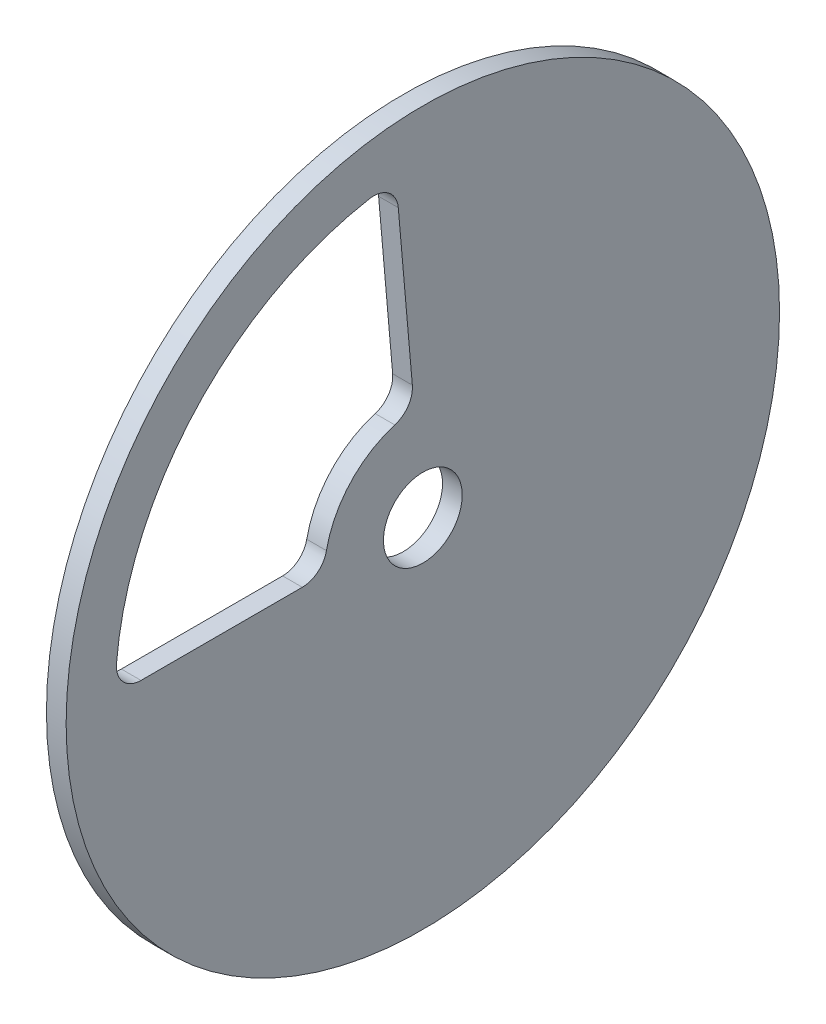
SolidWorks part; units mm, degrees
ref_plane "Front Plane" through (0, 0, 0) normal (0, 0, 1) x (1, 0, 0)
ref_plane "Top Plane" through (0, 0, 0) normal (0, 1, 0) x (1, 0, 0)
ref_plane "Right Plane" through (0, 0, 0) normal (1, 0, 0) x (0, 0, -1)
sketch "Sketch1" plane through (0, 0, 0) normal (1, 0, 0) x (0, 0, -1)
  line L0 (0, 0) -> (0, 13.3208) construction
  line L1 (-0.427, 4.8803) -> (-0.9985, 11.4128)
  line L2 (-4.899, 0) -> (-11.4564, 0)
  circle A0 centre (0, 0) radius 1.6
  circle A1 centre (0, 0) radius 14.5
  arc A2 (-2.1681, 12.3105) -> (-12.4527, 1.087) centre (0, 0) ccw
  arc A3 (-1.1385, 3.8345) -> (-3.9192, 0.8) centre (0, 0) ccw
  arc A4 (-4.899, 0) -> (-3.9192, 0.8) centre (-4.899, 1) ccw
  arc A5 (-0.427, 4.8803) -> (-1.1385, 3.8345) centre (-1.4232, 4.7932) cw
  arc A6 (-2.1681, 12.3105) -> (-0.9985, 11.4128) centre (-1.9947, 11.3257) cw
  arc A7 (-12.4527, 1.087) -> (-11.4564, 0) centre (-11.4564, 1) ccw
  dimension "D1" = 3.2
  dimension "D2" = 29
  dimension "D3" = 12.5
  dimension "D4" = 4
  dimension "D6" = 1
  dimension "D5" = 5
extrude "Boss-Extrude1" add sketch "Sketch1" along normal blind 0.8
